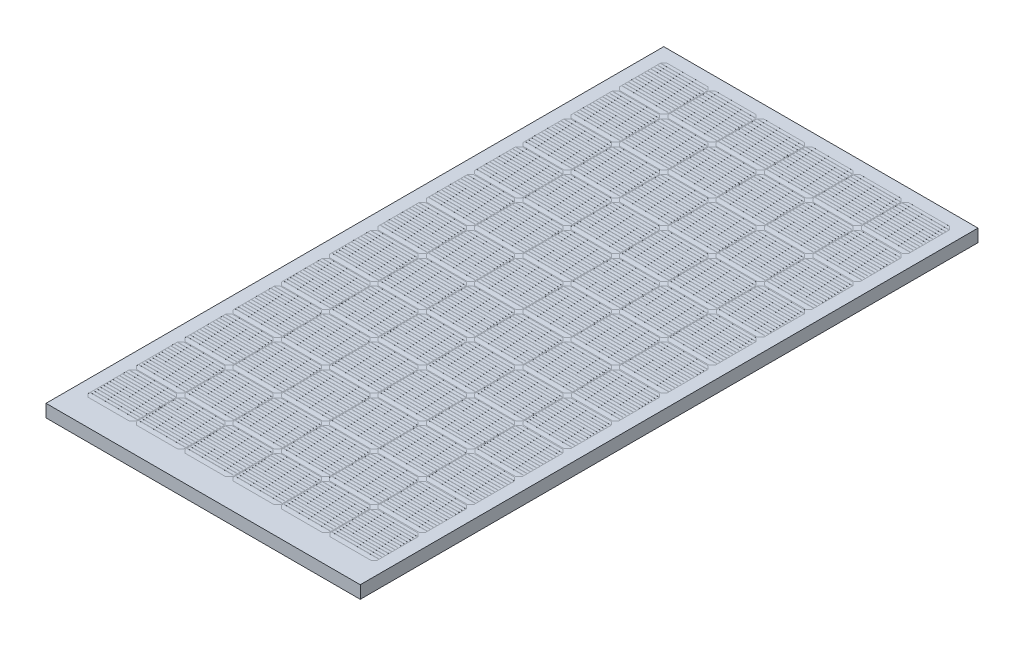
SolidWorks part; units mm, degrees
ref_plane "Front Plane" through (0, 0, 0) normal (0, 0, 1) x (1, 0, 0)
ref_plane "Top Plane" through (0, 0, 0) normal (0, 1, 0) x (1, 0, 0)
ref_plane "Right Plane" through (0, 0, 0) normal (1, 0, 0) x (0, 0, -1)
sketch "BaseS" plane through (0, 0, 0) normal (0, 1, 0) x (1, 0, 0)
  line L1 (-496, 975) -> (496, 975)
  line L2 (-496, 975) -> (-496, -975)
  line L3 (-496, -975) -> (496, -975)
  line L4 (496, 975) -> (496, -975)
  line L5 (-496, 975) -> (496, -975) construction
  line L6 (-496, -975) -> (496, 975) construction
  point P0 (0, 0)
  dimension "Width" = 1950
  dimension "Length" = 992
extrude "Base" add sketch "BaseS" along normal mid plane 40
sketch "LightAbsorptionSectionS" plane through (0, 20, 0) normal (0, 1, 0) x (1, 0, 0)
  line L0 (-303.5, 925) -> (-293.5, 935)
  line L5 (496, 975) -> (-496, 975) construction
  line L6 (-316.5, 935) -> (-306.5, 925)
  line L7 (-446, 935) -> (-316.5, 935)
  line L8 (-164, 935) -> (-154, 925)
  line L9 (-456, 925) -> (-456, 795.5)
  line L10 (-151, 925) -> (-141, 935)
  line L11 (-446, 785.5) -> (-316.5, 785.5)
  line L12 (-306.5, 925) -> (-306.5, 795.5)
  line L13 (-496, 975) -> (-496, -975) construction
  line L14 (496, -975) -> (496, 975) construction
  line L15 (-293.5, 935) -> (-164, 935)
  line L16 (-303.5, 925) -> (-303.5, 795.5)
  line L17 (-293.5, 785.5) -> (-164, 785.5)
  line L18 (-154, 925) -> (-154, 795.5)
  line L19 (-141, 935) -> (-11.5, 935)
  line L20 (-151, 925) -> (-151, 795.5)
  line L21 (-141, 785.5) -> (-11.5, 785.5)
  line L22 (-1.5, 925) -> (-1.5, 795.5)
  line L23 (11.5, 935) -> (141, 935)
  line L24 (1.5, 925) -> (1.5, 795.5)
  line L25 (11.5, 785.5) -> (141, 785.5)
  line L26 (151, 925) -> (151, 795.5)
  line L27 (316.5, 935) -> (446, 935)
  line L28 (306.5, 925) -> (306.5, 796)
  line L29 (316.5, 786) -> (446, 786)
  line L30 (456, 925) -> (456, 796)
  line L31 (-316.5, 785.5) -> (-306.5, 795.5)
  line L32 (164, 935) -> (293.5, 935)
  line L33 (154, 925) -> (154, 795.5)
  line L34 (164, 785.5) -> (293.5, 785.5)
  line L35 (303.5, 925) -> (303.5, 795.5)
  line L36 (-303.5, 795.5) -> (-293.5, 785.5)
  line L37 (-164, 785.5) -> (-154, 795.5)
  line L38 (-151, 795.5) -> (-141, 785.5)
  line L39 (-11.5, 935) -> (-1.5, 925)
  line L40 (-11.5, 785.5) -> (-1.5, 795.5)
  line L41 (1.5, 795.5) -> (11.5, 785.5)
  line L42 (1.5, 925) -> (11.5, 935)
  line L43 (141, 785.5) -> (151, 795.5)
  line L44 (141, 935) -> (151, 925)
  line L45 (154, 925) -> (164, 935)
  line L46 (154, 795.5) -> (164, 785.5)
  line L47 (293.5, 935) -> (303.5, 925)
  line L48 (293.5, 785.5) -> (303.5, 795.5)
  line L49 (306.5, 796) -> (316.5, 786)
  line L50 (306.5, 925) -> (316.5, 935)
  line L51 (446, 935) -> (456, 925)
  line L52 (446, 786) -> (456, 796)
  line L53 (-456, 925) -> (-446, 935)
  line L54 (-456, 795.5) -> (-446, 785.5)
  point P0 (-456, 935)
  point P1 (-306.5, 785.5)
  point P2 (-456, 785.5)
  point P3 (-306.5, 935)
  point P8 (-303.5, 935)
  point P9 (-154, 785.5)
  point P10 (-303.5, 785.5)
  point P11 (-154, 935)
  point P12 (-151, 935)
  point P13 (-1.5, 785.5)
  point P14 (-151, 785.5)
  point P15 (-1.5, 935)
  point P16 (1.5, 935)
  point P17 (151, 785.5)
  point P18 (1.5, 785.5)
  point P19 (151, 935)
  point P20 (306.5, 935)
  point P21 (456, 786)
  point P22 (306.5, 786)
  point P23 (456, 935)
  point P26 (154, 935)
  point P27 (303.5, 785.5)
  point P28 (154, 785.5)
  point P29 (303.5, 935)
  dimension "D1" = 40
  dimension "D2" = 40
  dimension "D3" = 40
  dimension "D4" = 149.5
  dimension "D5" = 3
  dimension "D6" = 3
  dimension "D7" = 3
  dimension "D8" = 3
  dimension "D9" = 3
extrude "LightAbsorptionSection" cut sketch "LightAbsorptionSectionS" against normal blind 0.03
pattern_linear "LPattern2" count 12 spacing 152.5 along (0, 0, 1) of "LightAbsorptionSection"
sketch "Sketch1" plane through (0, 19.97, 0) normal (0, 1, 0) x (1, 0, 0)
  line L0 (446, 935) -> (316.5, 935) construction
  line L8 (307.9794, 925) -> (454.1084, 925)
  line L9 (307.9794, 925) -> (307.9794, 924)
  line L10 (307.9794, 924) -> (454.1084, 924)
  line L11 (454.1084, 925) -> (454.1084, 924)
  line L13 (307.9794, 914.8) -> (307.9794, 913.8)
  line L14 (307.9794, 914.8) -> (454.1084, 914.8)
  line L15 (454.1084, 914.8) -> (454.1084, 913.8)
  line L16 (307.9794, 913.8) -> (454.1084, 913.8)
  line L21 (307.9794, 904.6) -> (307.9794, 903.6)
  line L22 (307.9794, 904.6) -> (454.1084, 904.6)
  line L23 (454.1084, 904.6) -> (454.1084, 903.6)
  line L24 (307.9794, 903.6) -> (454.1084, 903.6)
  line L29 (307.9794, 894.4) -> (307.9794, 893.4)
  line L30 (307.9794, 894.4) -> (454.1084, 894.4)
  line L31 (454.1084, 894.4) -> (454.1084, 893.4)
  line L32 (307.9794, 893.4) -> (454.1084, 893.4)
  line L37 (307.9794, 884.2) -> (307.9794, 883.2)
  line L38 (307.9794, 884.2) -> (454.1084, 884.2)
  line L39 (454.1084, 884.2) -> (454.1084, 883.2)
  line L40 (307.9794, 883.2) -> (454.1084, 883.2)
  line L45 (307.9794, 874) -> (307.9794, 873)
  line L46 (307.9794, 874) -> (454.1084, 874)
  line L47 (454.1084, 874) -> (454.1084, 873)
  line L48 (307.9794, 873) -> (454.1084, 873)
  line L53 (307.9794, 863.8) -> (307.9794, 862.8)
  line L54 (307.9794, 863.8) -> (454.1084, 863.8)
  line L55 (454.1084, 863.8) -> (454.1084, 862.8)
  line L56 (307.9794, 862.8) -> (454.1084, 862.8)
  line L61 (307.9794, 853.6) -> (307.9794, 852.6)
  line L62 (307.9794, 853.6) -> (454.1084, 853.6)
  line L63 (454.1084, 853.6) -> (454.1084, 852.6)
  line L64 (307.9794, 852.6) -> (454.1084, 852.6)
  line L69 (307.9794, 843.4) -> (307.9794, 842.4)
  line L70 (307.9794, 843.4) -> (454.1084, 843.4)
  line L71 (454.1084, 843.4) -> (454.1084, 842.4)
  line L72 (307.9794, 842.4) -> (454.1084, 842.4)
  line L77 (307.9794, 833.2) -> (307.9794, 832.2)
  line L78 (307.9794, 833.2) -> (454.1084, 833.2)
  line L79 (454.1084, 833.2) -> (454.1084, 832.2)
  line L80 (307.9794, 832.2) -> (454.1084, 832.2)
  line L85 (307.9794, 823) -> (307.9794, 822)
  line L86 (307.9794, 823) -> (454.1084, 823)
  line L87 (454.1084, 823) -> (454.1084, 822)
  line L88 (307.9794, 822) -> (454.1084, 822)
  line L93 (307.9794, 812.8) -> (307.9794, 811.8)
  line L94 (307.9794, 812.8) -> (454.1084, 812.8)
  line L95 (454.1084, 812.8) -> (454.1084, 811.8)
  line L96 (307.9794, 811.8) -> (454.1084, 811.8)
  line L101 (307.9794, 802.6) -> (307.9794, 801.6)
  line L102 (307.9794, 802.6) -> (454.1084, 802.6)
  line L103 (454.1084, 802.6) -> (454.1084, 801.6)
  line L104 (307.9794, 801.6) -> (454.1084, 801.6)
  line L109 (307.9794, 919.9) -> (454.1084, 919.9)
  line L110 (307.9794, 918.9) -> (454.1084, 918.9)
  line L111 (307.9794, 919.9) -> (307.9794, 918.9)
  line L112 (454.1084, 919.9) -> (454.1084, 918.9)
  line L113 (307.9794, 908.7) -> (454.1084, 908.7)
  line L114 (307.9794, 909.7) -> (454.1084, 909.7)
  line L115 (454.1084, 909.7) -> (454.1084, 908.7)
  line L116 (307.9794, 909.7) -> (307.9794, 908.7)
  line L117 (307.9794, 899.5) -> (454.1084, 899.5)
  line L118 (307.9794, 898.5) -> (454.1084, 898.5)
  line L119 (307.9794, 899.5) -> (307.9794, 898.5)
  line L120 (454.1084, 899.5) -> (454.1084, 898.5)
  line L121 (307.9794, 889.3) -> (454.1084, 889.3)
  line L122 (454.1084, 889.3) -> (454.1084, 888.3)
  line L123 (307.9794, 888.3) -> (454.1084, 888.3)
  line L124 (307.9794, 889.3) -> (307.9794, 888.3)
  line L125 (307.9794, 879.1) -> (307.9794, 878.1)
  line L126 (307.9794, 879.1) -> (454.1084, 879.1)
  line L127 (454.1084, 879.1) -> (454.1084, 878.1)
  line L128 (307.9794, 878.1) -> (454.1084, 878.1)
  line L129 (307.9794, 868.9) -> (454.1084, 868.9)
  line L130 (454.1084, 868.9) -> (454.1084, 867.9)
  line L131 (307.9794, 867.9) -> (454.1084, 867.9)
  line L132 (307.9794, 858.7) -> (454.1084, 858.7)
  line L133 (454.1084, 858.7) -> (454.1084, 857.7)
  line L134 (307.9794, 857.7) -> (454.1084, 857.7)
  line L135 (307.9794, 848.5) -> (454.1084, 848.5)
  line L136 (454.1084, 848.5) -> (454.1084, 847.5)
  line L137 (307.9794, 847.5) -> (454.1084, 847.5)
  line L138 (307.9794, 838.3) -> (454.1084, 838.3)
  line L139 (454.1084, 838.3) -> (454.1084, 837.3)
  line L140 (307.9794, 837.3) -> (454.1084, 837.3)
  line L141 (307.9794, 828.1) -> (454.1084, 828.1)
  line L142 (454.1084, 828.1) -> (454.1084, 827.1)
  line L143 (307.9794, 827.1) -> (454.1084, 827.1)
  line L144 (307.9794, 817.9) -> (454.1084, 817.9)
  line L145 (454.1084, 817.9) -> (454.1084, 816.9)
  line L146 (307.9794, 816.9) -> (454.1084, 816.9)
  line L147 (307.9794, 807.7) -> (454.1084, 807.7)
  line L148 (454.1084, 807.7) -> (454.1084, 806.7)
  line L149 (307.9794, 806.7) -> (454.1084, 806.7)
  line L150 (307.9794, 868.9) -> (307.9794, 867.9)
  line L151 (307.9794, 858.7) -> (307.9794, 857.7)
  line L152 (307.9794, 848.5) -> (307.9794, 847.5)
  line L153 (307.9794, 838.3) -> (307.9794, 837.3)
  line L154 (307.9794, 828.1) -> (307.9794, 827.1)
  line L155 (307.9794, 817.9) -> (307.9794, 816.9)
  line L156 (307.9794, 807.7) -> (307.9794, 806.7)
  line L157 (307.9794, 797.5) -> (454.1084, 797.5)
  line L158 (307.9794, 796.5) -> (454.1084, 796.5)
  line L159 (307.9794, 797.5) -> (307.9794, 796.5)
  line L160 (454.1084, 797.5) -> (454.1084, 796.5)
  dimension "D1" = 10
  dimension "D2" = 1
  dimension "D3" = 26
extrude "Boss-Extrude2" add sketch "Sketch1" along normal blind 0.05
pattern_linear "LPattern5" count 12 spacing 152.5 along (0, 0, 1) count 6 spacing 152.5 along (-1, 0, 0) of "Boss-Extrude2"
